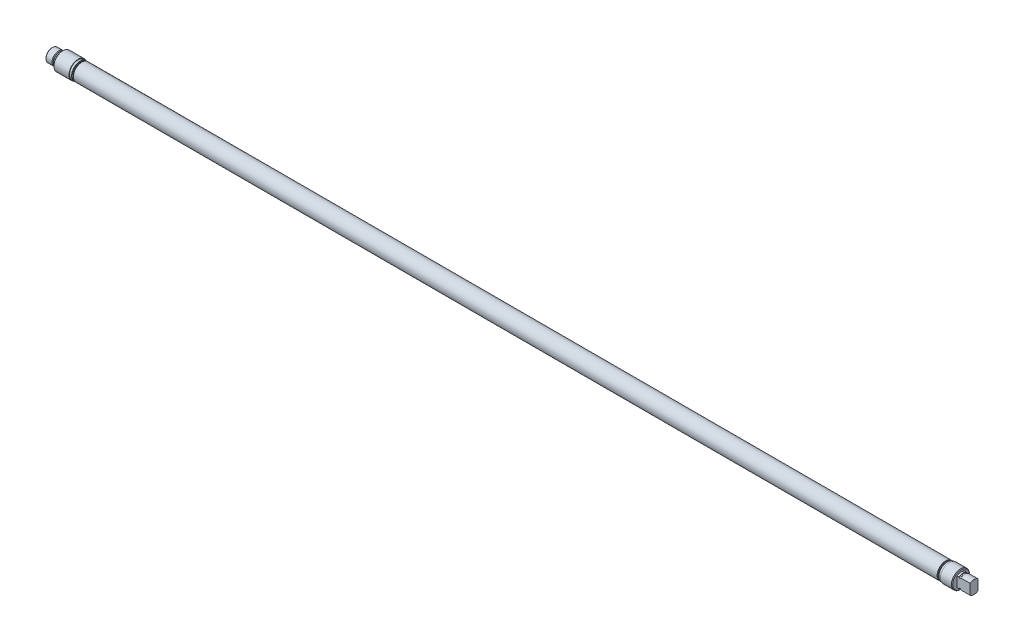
SolidWorks part; units mm, degrees
ref_plane "Front" through (0, 0, 0) normal (0, 0, 1) x (1, 0, 0)
ref_plane "Top" through (0, 0, 0) normal (0, 1, 0) x (1, 0, 0)
ref_plane "Right" through (0, 0, 0) normal (1, 0, 0) x (0, 0, -1)
sketch "Sketch2" plane through (0, 0, 0) normal (0, 0, 1) x (1, 0, 0)
  line L0 (1091.565, 10.287) -> (31.75, 10.287)
  line L1 (0, 7.9121) -> (8.0899, 7.9121)
  line L2 (0, 7.9121) -> (0, 0)
  line L3 (12.7, 10.922) -> (12.7, 7.9121)
  line L4 (1091.565, 10.922) -> (1091.565, 10.287)
  line L5 (1105.789, 50) -> (1105.789, -50) construction
  line L6 (0, 0) -> (1121.537, 0)
  line L7 (1105.789, 7.9121) -> (1105.789, 10.922)
  line L8 (-21.4174, 0) -> (42.4438, 0) construction
  line L9 (1091.565, 10.922) -> (1105.789, 10.922)
  line L10 (12.7, 10.922) -> (31.75, 10.922)
  line L11 (31.75, 10.922) -> (31.75, 10.287)
  line L12 (10.414, 7.9121) -> (10.414, 7.62)
  line L13 (9.906, 7.112) -> (9.1004, 7.112)
  line L14 (8.7412, 7.2608) -> (8.0899, 7.9121)
  line L15 (10.414, 7.9121) -> (12.7, 7.9121)
  line L16 (1105.789, 7.9121) -> (1108.075, 7.9121)
  line L17 (50, 0) -> (-50, 0) construction
  line L18 (1105.789, 10.287) -> (1105.789, -10.287) construction
  line L19 (12.7, 50) -> (12.7, -50) construction
  line L20 (1121.537, 7.9121) -> (1121.537, 0)
  line L21 (1108.075, 7.9121) -> (1108.075, 7.112)
  line L22 (1108.075, 7.112) -> (1109.599, 7.112)
  line L23 (1109.599, 7.112) -> (1110.3991, 7.9121)
  line L24 (1110.3991, 7.9121) -> (1121.537, 7.9121)
  arc A0 (9.1004, 7.112) -> (8.7412, 7.2608) centre (9.1004, 7.62) cw
  arc A1 (10.414, 7.62) -> (9.906, 7.112) centre (9.906, 7.62) cw
  point P26 (8.89, 7.112)
  point P30 (10.414, 7.112)
  dimension "D10" = 0.508
  dimension "D1" = 15.8242
  dimension "D2" = 12.7
  dimension "D3" = 14.224
  dimension "D4" = 21.844
  dimension "D5" = 31.75
  dimension "D6" = 1.524
  dimension "D7" = 2.286
  dimension "D8" = 14.224
  dimension "D9" = 45
  dimension "D11" = 2.286
  dimension "D12" = 1.524
  dimension "D13" = 45
  dimension "D14" = 15.748
revolve "Base-Revolve" add sketch "Sketch2" angle 360 about L8
sketch "Sketch3" plane through (0, 0, 0) normal (0, 0, 1) x (1, 0, 0)
  line L0 (34.29, 10.287) -> (34.29, 9.398)
  line L1 (34.29, 9.398) -> (35.179, 10.287)
  line L2 (35.179, 10.287) -> (34.29, 10.287)
  line L4 (35.56, 10.287) -> (35.56, 9.398)
  line L5 (35.56, 9.398) -> (36.449, 10.287)
  line L6 (36.449, 10.287) -> (35.56, 10.287)
  line L9 (31.75, -10.922) -> (31.75, 10.922) construction
  line L15 (0, 0) -> (35.6608, 0) construction
  line L16 (50, 0) -> (-50, 0) construction
  circle A0 centre (34.925, 9.398) radius 0.635 construction
  dimension "D4" = 20.574
  dimension "D1" = 1.27
  dimension "D2" = 0.889
  dimension "D3" = 2.54
revolve "Cut-Revolve1" cut sketch "Sketch3" angle 360 about L15
sketch "Sketch6" plane through (0, 0, 0) normal (0, 0, 1) x (1, 0, 0)
  line L0 (0, 0) -> (-63.9853, 0) construction
  line L1 (12.7, 0) -> (1105.789, 0) construction
  line L2 (1073.5945, 0) -> (1073.5945, 9.525)
  line L3 (1073.5945, 9.525) -> (44.8945, 9.525)
  line L4 (44.8945, 9.525) -> (44.8945, 3.175)
  line L5 (44.8945, 3.175) -> (0, 3.175)
  line L6 (0, 3.175) -> (0, 0)
  line L7 (0, 0) -> (1073.5945, 0)
  line L8 (1073.5945, 10.287) -> (1073.5945, -10.287) construction
  line L10 (44.8945, 10.287) -> (44.8945, -10.287) construction
  line L11 (50, 0) -> (-50, 0) construction
  line L12 (0, 7.9121) -> (0, -7.9121) construction
  dimension "D1" = 6.35
  dimension "D2" = 19.05
revolve "Cut-Revolve2" cut sketch "Sketch6" angle 360 about L0
sketch "Sketch13" plane through (0, 0, 0) normal (0, 0, 1) x (1, 0, 0)
  line L0 (-4.5831, 0) -> (1121.537, 0) construction
  line L2 (1086.993, 10.287) -> (1087.755, 10.287)
  line L3 (1087.755, 10.287) -> (1087.755, 9.525)
  line L4 (1086.993, 10.287) -> (1087.755, 9.525)
  line L5 (1088.263, 10.287) -> (1089.025, 10.287)
  line L6 (1089.025, 10.287) -> (1089.025, 9.525)
  line L7 (1088.263, 10.287) -> (1089.025, 9.525)
  line L8 (1091.565, 10.922) -> (1091.565, -10.922) construction
  line L9 (1121.537, -7.9121) -> (1121.537, 7.9121) construction
  dimension "D1" = 0.762
  dimension "D2" = 1.27
  dimension "D3" = 2.54
  dimension "D4" = 20.574
revolve "Cut-Revolve5" cut sketch "Sketch13" angle 360 about L0
ref_plane "Plane1" through (22.225, 10.922, 0) normal (0, 1, 0) x (0, 0, -1)
sketch "Sketch14" plane through (0, 0, 0) normal (0, 1, 0) x (1, 0, 0)
  line L0 (1105.789, -10.922) -> (1105.789, 10.922) construction
  line L1 (1121.537, 7.9121) -> (1105.789, 7.9121)
  line L2 (1121.537, 7.9121) -> (1121.537, 4.826)
  line L3 (1121.537, 4.826) -> (1105.789, 4.826)
  line L4 (1105.789, 7.9121) -> (1105.789, 4.826)
  line L5 (1105.789, -7.9121) -> (1105.789, 7.9121) construction
  line L6 (1121.537, -7.9121) -> (1105.789, -7.9121)
  line L7 (1121.537, -7.9121) -> (1121.537, -4.826)
  line L8 (1121.537, -4.826) -> (1105.789, -4.826)
  line L9 (1105.789, -7.9121) -> (1105.789, -4.826)
  line L10 (163.4408, 0) -> (103.8566, 0) construction
  dimension "D1" = 9.652
extrude "Cut-Extrude1" cut sketch "Sketch14" against normal through all and the other way through all
chamfer "Chamfer1" distance 0.762 angle 45 3 edges at (0, 0, 7.9121) (1105.789, 0, 10.922) (12.7, 0, 10.922)
